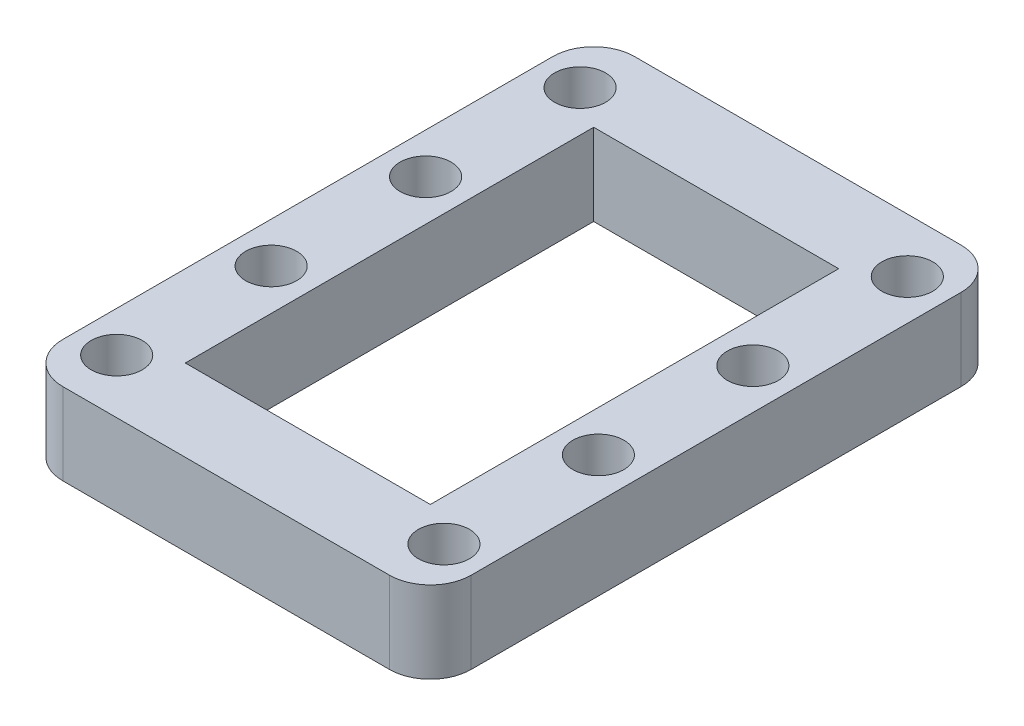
SolidWorks part; units mm, degrees
ref_plane "Front Plane" through (0, 0, 0) normal (0, 0, 1) x (1, 0, 0)
ref_plane "Top Plane" through (0, 0, 0) normal (0, 1, 0) x (1, 0, 0)
ref_plane "Right Plane" through (0, 0, 0) normal (1, 0, 0) x (0, 0, -1)
imported_body "64179 - Base v2.step"
sketch "Sketch1" plane through (0, 8, 0) normal (0, 1, 0) x (1, 0, 0)
  circle A0 centre (16, -24) radius 3 construction
  circle A1 centre (16, -8) radius 3 construction
  circle A2 centre (16, 8) radius 3 construction
  circle A3 centre (16, 24) radius 3 construction
  circle A4 centre (-16, 24) radius 3 construction
  circle A5 centre (-16, 8) radius 3 construction
  circle A6 centre (-16, -8) radius 3 construction
  circle A7 centre (-16, -24) radius 3 construction
  circle A8 centre (16, -24) radius 3
  circle A9 centre (16, -8) radius 3
  circle A10 centre (16, 8) radius 3
  circle A11 centre (16, 24) radius 3
  circle A12 centre (-16, 24) radius 3
  circle A13 centre (-16, 8) radius 3
  circle A14 centre (-16, -8) radius 3
  circle A15 centre (-16, -24) radius 3
extrude "Boss-Extrude1" add sketch "Sketch1" against normal up to surface (8 mm away)
sketch "Sketch3" plane through (0, 8, 0) normal (0, 1, 0) x (1, 0, 0)
  line L0 (-20, 0) -> (20, 0) construction
  line L1 (-20, 24) -> (-20, -24) construction
  line L2 (20, -24) -> (20, 24) construction
  line L3 (-16.027, -22.695) -> (-16.027, -7.565) construction
  line L4 (-16.027, -7.565) -> (-16.027, 7.565) construction
  line L5 (0, 0) -> (0, 20) construction
  line L6 (-12, 20) -> (12, 20) construction
  line L7 (0, 0) -> (0, -20) construction
  line L8 (12, -20) -> (-12, -20) construction
  line L9 (-16.027, 7.565) -> (-16.027, 22.695) construction
  circle A0 centre (-16.027, -22.695) radius 2.5
  circle A1 centre (-16.027, -7.565) radius 2.5
  circle A2 centre (-16.027, 7.565) radius 2.5
  circle A3 centre (16.027, -22.695) radius 2.5
  circle A4 centre (16.027, -7.565) radius 2.5
  circle A5 centre (16.027, 7.565) radius 2.5
  circle A6 centre (-16.027, 22.695) radius 2.5
  circle A7 centre (16.027, 22.695) radius 2.5
  point P32 (-16.027, 0)
  dimension "D3" = 5
  dimension "D1" = 45.39
  dimension "D2" = 15.13
extrude "Cut-Extrude1" cut sketch "Sketch3" against normal through all contours A1 | A0 | A3 | A4 | A5 | A2 | A6 | A7
